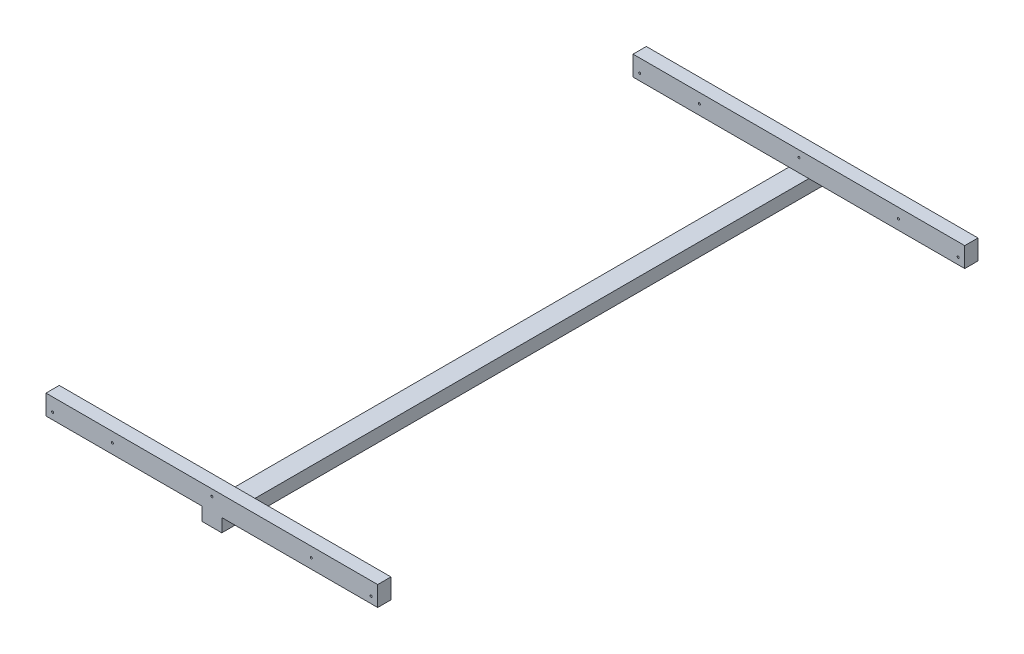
SolidWorks part; units mm, degrees
ref_plane "Plan de face" through (0, 0, 0) normal (0, 0, 1) x (1, 0, 0)
ref_plane "Plan de dessus" through (0, 0, 0) normal (0, 1, 0) x (1, 0, 0)
ref_plane "Plan de droite" through (0, 0, 0) normal (1, 0, 0) x (0, 0, -1)
sketch "Esquisse1" plane through (0, 0, 0) normal (0, 0, 1) x (1, 0, 0)
  line L1 (30, -20) -> (-30, -20)
  line L2 (30, -20) -> (30, 20)
  line L3 (30, 20) -> (-30, 20)
  line L4 (-30, -20) -> (-30, 20)
  line L5 (30, -20) -> (-30, 20) construction
  line L6 (30, 20) -> (-30, -20) construction
  point P0 (0, 0)
  dimension "D1" = 60
  dimension "D2" = 40
extrude "Boss.-Extru.1" add sketch "Esquisse1" along normal mid plane 1810
sketch "Esquisse2" plane through (0, 0, 0) normal (1, 0, 0) x (0, 0, -1)
  line L0 (0, 0) -> (0, 364.5271) construction
  line L1 (-865, 80) -> (-905, 80)
  line L2 (-865, 80) -> (-865, 20)
  line L3 (-865, 20) -> (-905, 20)
  line L4 (-905, 80) -> (-905, 20)
  line L5 (-865, 80) -> (-905, 20) construction
  line L6 (-865, 20) -> (-905, 80) construction
  line L7 (865, 20) -> (905, 80) construction
  line L8 (865, 80) -> (905, 20) construction
  line L9 (905, 80) -> (905, 20)
  line L10 (865, 20) -> (905, 20)
  line L11 (865, 80) -> (865, 20)
  line L12 (865, 80) -> (905, 80)
  point P0 (-885, 50)
  point P13 (885, 50)
  dimension "D1" = 40
  dimension "D2" = 60
extrude "Boss.-Extru.2" add sketch "Esquisse2" along normal mid plane 1000
sketch "Esquisse3" plane through (0, 0, 905) normal (0, 0, 1) x (1, 0, 0)
  line L0 (0, 0) -> (0, 205.1271) construction
  line L1 (500, 20) -> (30, 20) construction
  line L2 (500, 80) -> (-500, 80) construction
  line L3 (-30, 20) -> (-500, 20) construction
  circle A0 centre (0, 60) radius 3
  circle A1 centre (480, 40) radius 3
  circle A2 centre (-480, 40) radius 3
  circle A3 centre (-300, 50) radius 3
  circle A4 centre (300, 50) radius 3
  dimension "D2" = 20
  dimension "D3" = 20
  dimension "D4" = 20
  dimension "D5" = 6
  dimension "D6" = 6
  dimension "D7" = 30
  dimension "D8" = 300
  dimension "D1" = 960
extrude "Enlèv. mat.-Extru.1" cut sketch "Esquisse3" against normal through all both and the other way through all
